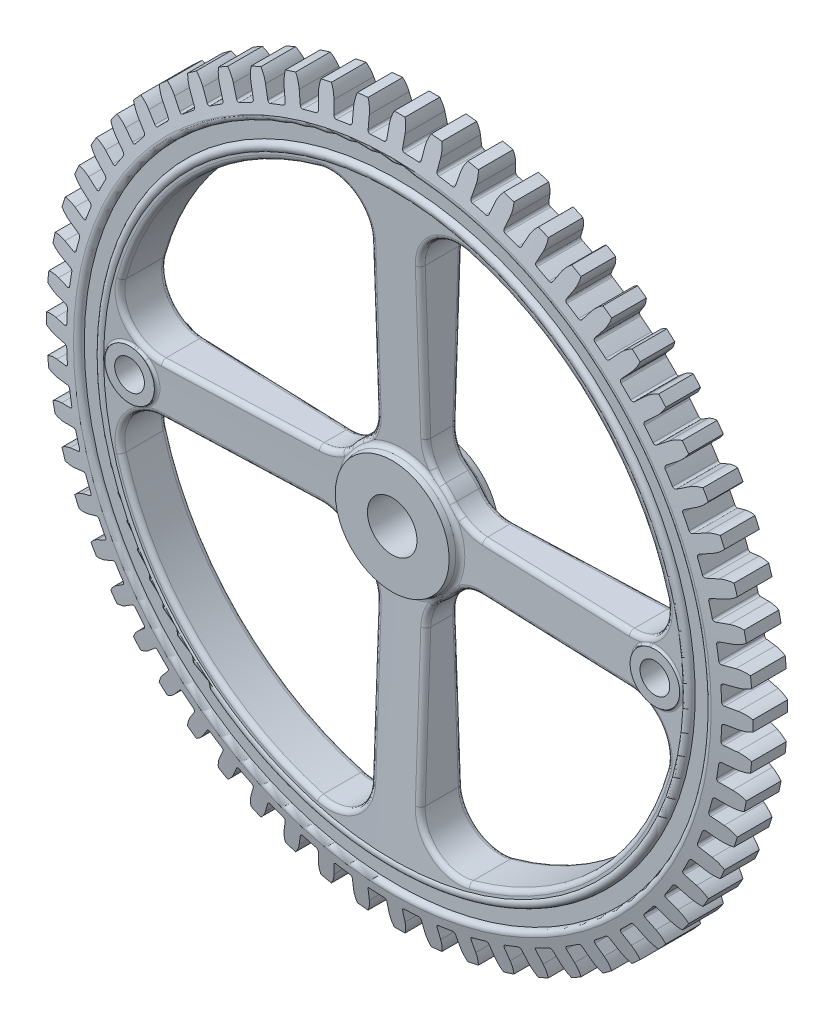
SolidWorks part; units mm, degrees
ref_plane "Спереди" through (0, 0, 0) normal (0, 0, 1) x (1, 0, 0)
ref_plane "Сверху" through (0, 0, 0) normal (0, 1, 0) x (1, 0, 0)
ref_plane "Справа" through (0, 0, 0) normal (1, 0, 0) x (0, 0, -1)
sketch "Эскиз1" plane through (0, 0, 0) normal (0, 1, 0) x (1, 0, 0)
  line L0 (-71.3, 0) -> (0, 0) construction
  line L1 (-71.3, -3.5) -> (-71.3, 3.5)
  line L2 (-5, 5) -> (-5, -5)
  line L3 (-5, 5) -> (-11.485, 5)
  line L4 (-71.3, 3.5) -> (-64.3459, 4.9781)
  line L5 (-63.138, 4) -> (-60.138, 4)
  line L6 (-11.485, 5) -> (-11.7073, 3.8775)
  line L7 (-12.7249, 3.0724) -> (-58.4765, 4.75)
  line L8 (-5, -5) -> (-11.485, -5)
  line L9 (-11.485, -5) -> (-11.7073, -3.8775)
  line L10 (-12.7249, -3.0724) -> (-58.4765, -4.75)
  line L11 (-63.138, -4) -> (-60.138, -4)
  line L12 (-71.3, -3.5) -> (-64.3459, -4.9781)
  line L13 (0, 5) -> (0, -5) construction
  arc A0 (-63.138, 4) -> (-64.3459, 4.9781) centre (-64.138, 4) ccw
  arc A1 (-58.4765, 4.75) -> (-60.138, 4) centre (-59.138, 4) ccw
  arc A2 (-11.7073, 3.8775) -> (-12.7249, 3.0724) centre (-12.6882, 4.0717) cw
  arc A3 (-11.7073, -3.8775) -> (-12.7249, -3.0724) centre (-12.6882, -4.0717) ccw
  arc A4 (-58.4765, -4.75) -> (-60.138, -4) centre (-59.138, -4) cw
  arc A5 (-63.138, -4) -> (-64.3459, -4.9781) centre (-64.138, -4) cw
  point P17 (-5, 0)
  dimension "D7" = 2
  dimension "D13" = 1
  dimension "D1" = 71.3
  dimension "D2" = 5
  dimension "D3" = 5
  dimension "D4" = 6.485
  dimension "D5" = 3.5
  dimension "D6" = 12
  dimension "D8" = 3
  dimension "D9" = 4
  dimension "D10" = 11.2
  dimension "D11" = 2.1
  dimension "D12" = 0.25
revolve "Повернуть1" add sketch "Эскиз1" angle 360 about L13
sketch "Эскиз2" plane through (0, 0, 0) normal (0, 0, 1) x (1, 0, 0)
  line L0 (0, 87.2902) -> (0, 0) construction
  line L1 (0, 0) -> (53, 0) construction
  line L2 (5, 47.244) -> (5, 16.4924)
  line L3 (16.4924, 5) -> (47.244, 5)
  line L4 (47.244, -5) -> (16.4924, -5)
  line L5 (5, -16.4924) -> (5, -47.244)
  line L6 (-5, -47.244) -> (-5, -16.4924)
  line L7 (-16.4924, -5) -> (-47.244, -5)
  line L8 (-47.244, 5) -> (-16.4924, 5)
  line L9 (-5, 16.4924) -> (-5, 47.244)
  line L10 (0, 0) -> (-53, 0) construction
  arc A0 (10.2096, 8.0476) -> (8.0476, 10.2096) centre (0, 0) ccw
  arc A1 (54.9574, 15.1224) -> (15.1224, 54.9574) centre (0, 0) ccw
  arc A2 (47.244, 5) -> (54.9574, 15.1224) centre (47.244, 13) ccw
  arc A3 (16.4924, 5) -> (10.2096, 8.0476) centre (16.4924, 13) cw
  arc A4 (5, 16.4924) -> (8.0476, 10.2096) centre (13, 16.4924) ccw
  arc A5 (5, 47.244) -> (15.1224, 54.9574) centre (13, 47.244) cw
  arc A6 (8.0476, -10.2096) -> (10.2096, -8.0476) centre (0, 0) ccw
  arc A7 (15.1224, -54.9574) -> (54.9574, -15.1224) centre (0, 0) ccw
  arc A8 (5, -47.244) -> (15.1224, -54.9574) centre (13, -47.244) ccw
  arc A9 (5, -16.4924) -> (8.0476, -10.2096) centre (13, -16.4924) cw
  arc A10 (16.4924, -5) -> (10.2096, -8.0476) centre (16.4924, -13) ccw
  arc A11 (47.244, -5) -> (54.9574, -15.1224) centre (47.244, -13) cw
  arc A12 (-10.2096, -8.0476) -> (-8.0476, -10.2096) centre (0, 0) ccw
  arc A13 (-54.9574, -15.1224) -> (-15.1224, -54.9574) centre (0, 0) ccw
  arc A14 (-47.244, -5) -> (-54.9574, -15.1224) centre (-47.244, -13) ccw
  arc A15 (-16.4924, -5) -> (-10.2096, -8.0476) centre (-16.4924, -13) cw
  arc A16 (-5, -16.4924) -> (-8.0476, -10.2096) centre (-13, -16.4924) ccw
  arc A17 (-5, -47.244) -> (-15.1224, -54.9574) centre (-13, -47.244) cw
  arc A18 (-8.0476, 10.2096) -> (-10.2096, 8.0476) centre (0, 0) ccw
  arc A19 (-15.1224, 54.9574) -> (-54.9574, 15.1224) centre (0, 0) ccw
  arc A20 (-5, 47.244) -> (-15.1224, 54.9574) centre (-13, 47.244) ccw
  arc A21 (-5, 16.4924) -> (-8.0476, 10.2096) centre (-13, 16.4924) cw
  arc A22 (-16.4924, 5) -> (-10.2096, 8.0476) centre (-16.4924, 13) ccw
  arc A23 (-47.244, 5) -> (-54.9574, 15.1224) centre (-47.244, 13) cw
  circle A24 centre (-53, 0) radius 3
  circle A25 centre (53, 0) radius 3
  dimension "D3" = 26
  dimension "D4" = 114
  dimension "D5" = 8
  dimension "D8" = 6
  dimension "D1" = 5
  dimension "D2" = 5
  dimension "D7" = 10
  dimension "D9" = 53
  dimension "D6" = 4
extrude "Вырез-Вытянуть1" cut sketch "Эскиз2" against normal mid plane 10
sketch "Эскиз4" plane through (0, 0, 0) normal (0, 0, 1) x (1, 0, 0)
  line L0 (-53, 0) -> (0, 0) construction
  line L1 (-53, 3) -> (-53, -3) construction
  line L2 (53, 3) -> (53, -3) construction
  line L3 (0, 0) -> (53, 0) construction
  circle A0 centre (-53, 0) radius 5
  circle A1 centre (-53, 0) radius 3 construction
  circle A2 centre (53, 0) radius 5
  circle A3 centre (53, 0) radius 3 construction
  circle A4 centre (-53, 0) radius 3
  circle A5 centre (53, 0) radius 3
  dimension "D2" = 10
extrude "Бобышка-Вытянуть1" add sketch "Эскиз4" along normal mid plane 10
fillet "Скругление1" radius 1 64 edges at (-12.1999, 6.2492, -3.1084) (-9.1924, 9.1924, -3.0825) (-5.4509, 13.8447, -3.1514) (-7.5875, 53.1351, -4.5739) (-40.3051, 40.3051, -4.6959) (-6.2492, -12.1999, -3.1084) (-9.1924, -9.1924, -3.0825) (-13.8447, -5.4509, -3.1514) (-53.1351, -7.5875, -4.5739) (-40.3051, -40.3051, -4.6959) (-8.7638, -54.0304, -4.6129) (12.1999, -6.2492, -3.1084) (9.1924, -9.1924, -3.0825) (5.4509, -13.8447, -3.1514) (7.5875, -53.1351, -4.5739) (40.3051, -40.3051, -4.6959) (54.0304, -8.7638, -4.6129) (53.1351, 7.5875, -4.5739) (40.3051, 40.3051, -4.6959) (8.7638, 54.0304, -4.6129) (6.2492, 12.1999, -3.1084) (9.1924, 9.1924, -3.0825) (13.8447, 5.4509, -3.1514) (12.1999, 6.2492, 3.1084) (9.1924, 9.1924, 3.0825) (5.4509, 13.8447, 3.1514) (7.5875, 53.1351, 4.5739) (40.3051, 40.3051, 4.6959) (54.0304, 8.7638, 4.6129) (53.1351, -7.5875, 4.5739) (40.3051, -40.3051, 4.6959) (8.7638, -54.0304, 4.6129) (6.2492, -12.1999, 3.1084) (9.1924, -9.1924, 3.0825) (13.8447, -5.4509, 3.1514) (-12.1999, -6.2492, 3.1084) (-9.1924, -9.1924, 3.0825) (-5.4509, -13.8447, 3.1514) (-7.5875, -53.1351, 4.5739) (-40.3051, -40.3051, 4.6959) (-54.0304, -8.7638, 4.6129) (-40.3051, 40.3051, 4.6959) (-8.7638, 54.0304, 4.6129) (-6.2492, 12.1999, 3.1084) (-9.1924, 9.1924, 3.0825) (-13.8447, 5.4509, 3.1514) (-54.0304, 8.7638, -4.6129) (-53.1351, 7.5875, 4.5739)
fillet "Скругление2" radius 0.5 4 edges at (57.2607, 2.6166, 4.7076) (-48.7562, 2.6439, 4.3962) (-50.3886, 4.2639, -4.46) (55.6381, 4.2474, -4.6519)
sketch "Эскиз5" plane through (0, 0, 0) normal (0, 0, 1) x (1, 0, 0)
  line L0 (0, 80.2004) -> (0, -81.6903) construction
  line L1 (0, 0) -> (3.6112, 68.9054) construction
  line L2 (-1.6, 68.8596) -> (-1.6, 66.5669)
  line L3 (1.6, 68.8596) -> (1.6, 66.5669)
  line L4 (5.6065, 68.6496) -> (5.3669, 66.3695)
  line L5 (8.789, 68.3151) -> (8.5494, 66.035)
  line L6 (12.7517, 67.6875) -> (12.275, 65.4449)
  line L7 (15.8817, 67.0222) -> (15.4051, 64.7796)
  line L8 (19.7571, 65.9838) -> (19.0486, 63.8033)
  line L9 (22.8005, 64.9949) -> (22.092, 62.8144)
  line L10 (26.546, 63.5571) -> (25.6135, 61.4627)
  line L11 (29.4694, 62.2556) -> (28.5369, 60.1611)
  line L12 (33.0441, 60.4341) -> (31.8978, 58.4486)
  line L13 (35.8154, 58.8341) -> (34.6691, 56.8486)
  line L14 (39.1802, 56.649) -> (37.8326, 54.7942)
  line L15 (41.7691, 54.7681) -> (40.4215, 52.9133)
  line L16 (44.887, 52.2432) -> (43.3529, 50.5394)
  line L17 (47.2651, 50.102) -> (45.731, 48.3982)
  line L18 (50.102, 47.2651) -> (48.3982, 45.731)
  line L19 (52.2432, 44.887) -> (50.5394, 43.3529)
  line L20 (54.7681, 41.7691) -> (52.9133, 40.4215)
  line L21 (56.649, 39.1802) -> (54.7942, 37.8326)
  line L22 (58.8341, 35.8154) -> (56.8486, 34.6691)
  line L23 (60.4341, 33.0441) -> (58.4486, 31.8978)
  line L24 (62.2556, 29.4694) -> (60.1611, 28.5369)
  line L25 (63.5571, 26.546) -> (61.4627, 25.6135)
  line L26 (64.9949, 22.8005) -> (62.8144, 22.092)
  line L27 (65.9838, 19.7571) -> (63.8033, 19.0486)
  line L28 (67.0222, 15.8817) -> (64.7796, 15.4051)
  line L29 (67.6875, 12.7517) -> (65.4449, 12.275)
  line L30 (68.3151, 8.789) -> (66.035, 8.5494)
  line L31 (68.6496, 5.6065) -> (66.3695, 5.3669)
  line L32 (68.8596, 1.6) -> (66.5669, 1.6)
  line L33 (68.8596, -1.6) -> (66.5669, -1.6)
  line L34 (68.6496, -5.6065) -> (66.3695, -5.3669)
  line L35 (68.3151, -8.789) -> (66.035, -8.5494)
  line L36 (67.6875, -12.7517) -> (65.4449, -12.275)
  line L37 (67.0222, -15.8817) -> (64.7796, -15.4051)
  line L38 (65.9838, -19.7571) -> (63.8033, -19.0486)
  line L39 (64.9949, -22.8005) -> (62.8144, -22.092)
  line L40 (63.5571, -26.546) -> (61.4627, -25.6135)
  line L41 (62.2556, -29.4694) -> (60.1611, -28.5369)
  line L42 (60.4341, -33.0441) -> (58.4486, -31.8978)
  line L43 (58.8341, -35.8154) -> (56.8486, -34.6691)
  line L44 (56.649, -39.1802) -> (54.7942, -37.8326)
  line L45 (54.7681, -41.7691) -> (52.9133, -40.4215)
  line L46 (52.2432, -44.887) -> (50.5394, -43.3529)
  line L47 (50.102, -47.2651) -> (48.3982, -45.731)
  line L48 (47.2651, -50.102) -> (45.731, -48.3982)
  line L49 (44.887, -52.2432) -> (43.3529, -50.5394)
  line L50 (41.7691, -54.7681) -> (40.4215, -52.9133)
  line L51 (39.1802, -56.649) -> (37.8326, -54.7942)
  line L52 (35.8154, -58.8341) -> (34.6691, -56.8486)
  line L53 (33.0441, -60.4341) -> (31.8978, -58.4486)
  line L54 (29.4694, -62.2556) -> (28.3391, -59.7169)
  line L55 (26.546, -63.5571) -> (25.6135, -61.4627)
  line L56 (22.8005, -64.9949) -> (22.092, -62.8144)
  line L57 (19.7571, -65.9838) -> (19.0486, -63.8033)
  line L58 (15.8817, -67.0222) -> (15.4051, -64.7796)
  line L59 (12.7517, -67.6875) -> (12.275, -65.4449)
  line L60 (8.789, -68.3151) -> (8.5494, -66.035)
  line L61 (5.6065, -68.6496) -> (5.3669, -66.3695)
  line L62 (1.6, -68.8596) -> (1.6, -66.5669)
  line L63 (-1.6, -68.8596) -> (-1.6, -66.5669)
  line L64 (-5.6065, -68.6496) -> (-5.3161, -65.8859)
  line L65 (-8.789, -68.3151) -> (-8.5494, -66.035)
  line L66 (-12.7517, -67.6875) -> (-12.275, -65.4449)
  line L67 (-15.8817, -67.0222) -> (-15.4051, -64.7796)
  line L68 (-19.7571, -65.9838) -> (-19.0486, -63.8033)
  line L69 (-22.8005, -64.9949) -> (-22.092, -62.8144)
  line L70 (-26.546, -63.5571) -> (-25.6135, -61.4627)
  line L71 (-29.4694, -62.2556) -> (-28.5369, -60.1611)
  line L72 (-33.0441, -60.4341) -> (-31.8978, -58.4486)
  line L73 (-35.8154, -58.8341) -> (-34.6691, -56.8486)
  line L74 (-39.1802, -56.649) -> (-37.8326, -54.7942)
  line L75 (-41.7691, -54.7681) -> (-40.4215, -52.9133)
  line L76 (-44.887, -52.2432) -> (-43.3529, -50.5394)
  line L77 (-47.2651, -50.102) -> (-45.731, -48.3982)
  line L78 (-50.102, -47.2651) -> (-48.3982, -45.731)
  line L79 (-52.2432, -44.887) -> (-50.5394, -43.3529)
  line L80 (-54.7681, -41.7691) -> (-52.9133, -40.4215)
  line L81 (-56.649, -39.1802) -> (-54.7942, -37.8326)
  line L82 (-58.8341, -35.8154) -> (-56.8486, -34.6691)
  line L83 (-60.4341, -33.0441) -> (-58.4486, -31.8978)
  line L84 (-62.2556, -29.4694) -> (-60.1611, -28.5369)
  line L85 (-63.5571, -26.546) -> (-61.4627, -25.6135)
  line L86 (-64.9949, -22.8005) -> (-62.8144, -22.092)
  line L87 (-65.9838, -19.7571) -> (-63.8033, -19.0486)
  line L88 (-67.0222, -15.8817) -> (-64.7796, -15.4051)
  line L89 (-67.6875, -12.7517) -> (-65.4449, -12.275)
  line L90 (-68.3151, -8.789) -> (-66.035, -8.5494)
  line L91 (-68.6496, -5.6065) -> (-66.3695, -5.3669)
  line L92 (-68.8596, -1.6) -> (-66.5669, -1.6)
  line L93 (-68.8596, 1.6) -> (-66.5669, 1.6)
  line L94 (-68.6496, 5.6065) -> (-66.3695, 5.3669)
  line L95 (-68.3151, 8.789) -> (-66.035, 8.5494)
  line L96 (-67.6875, 12.7517) -> (-65.4449, 12.275)
  line L97 (-67.0222, 15.8817) -> (-64.7796, 15.4051)
  line L98 (-65.9838, 19.7571) -> (-63.8033, 19.0486)
  line L99 (-64.9949, 22.8005) -> (-62.8144, 22.092)
  line L100 (-63.5571, 26.546) -> (-61.4627, 25.6135)
  line L101 (-62.2556, 29.4694) -> (-60.1611, 28.5369)
  line L102 (-60.4341, 33.0441) -> (-58.4486, 31.8978)
  line L103 (-58.8341, 35.8154) -> (-56.8486, 34.6691)
  line L104 (-56.649, 39.1802) -> (-54.7942, 37.8326)
  line L105 (-54.7681, 41.7691) -> (-52.9133, 40.4215)
  line L106 (-52.2432, 44.887) -> (-50.5394, 43.3529)
  line L107 (-50.102, 47.2651) -> (-48.3982, 45.731)
  line L108 (-47.2651, 50.102) -> (-45.731, 48.3982)
  line L109 (-44.887, 52.2432) -> (-43.3529, 50.5394)
  line L110 (-41.7691, 54.7681) -> (-40.4215, 52.9133)
  line L111 (-39.1802, 56.649) -> (-37.8326, 54.7942)
  line L112 (-35.8154, 58.8341) -> (-34.6691, 56.8486)
  line L113 (-33.0441, 60.4341) -> (-31.8978, 58.4486)
  line L114 (-29.4694, 62.2556) -> (-28.5369, 60.1611)
  line L115 (-26.546, 63.5571) -> (-25.6135, 61.4627)
  line L116 (-22.8005, 64.9949) -> (-22.092, 62.8144)
  line L117 (-19.7571, 65.9838) -> (-19.0486, 63.8033)
  line L118 (-15.8817, 67.0222) -> (-15.4051, 64.7796)
  line L119 (-12.7517, 67.6875) -> (-12.275, 65.4449)
  line L120 (-8.789, 68.3151) -> (-8.5494, 66.035)
  line L121 (-5.6065, 68.6496) -> (-5.3669, 66.3695)
  arc A0 (-2.0842, 66.0671) -> (-4.8331, 65.9231) centre (0, 0) ccw
  circle A1 centre (0, 0) radius 71.3 construction
  arc A2 (-1.0849, 71.2917) -> (-1.6, 68.8596) centre (4.4, 68.8596) ccw
  circle A3 centre (0, 0) radius 69 construction
  arc A4 (1.0849, 71.2917) -> (1.6, 68.8596) centre (-4.4, 68.8596) cw
  arc A5 (1.0849, 71.2917) -> (-1.0849, 71.2917) centre (0, 0) ccw
  arc A6 (6.373, 71.0146) -> (5.6065, 68.6496) centre (11.5737, 68.0224) ccw
  arc A7 (8.531, 70.7878) -> (8.789, 68.3151) centre (2.8219, 68.9423) cw
  arc A8 (8.531, 70.7878) -> (6.373, 71.0146) centre (0, 0) ccw
  arc A9 (13.7612, 69.9594) -> (12.7517, 67.6875) centre (18.6206, 66.44) ccw
  arc A10 (15.8836, 69.5083) -> (15.8817, 67.0222) centre (10.0129, 68.2696) cw
  arc A11 (15.8836, 69.5083) -> (13.7612, 69.9594) centre (0, 0) ccw
  arc A12 (20.9985, 68.1377) -> (19.7571, 65.9838) centre (25.4634, 64.1297) ccw
  arc A13 (23.0622, 67.4672) -> (22.8005, 64.9949) centre (17.0941, 66.849) cw
  arc A14 (23.0622, 67.4672) -> (20.9985, 68.1377) centre (0, 0) ccw
  arc A15 (28.0058, 65.5695) -> (26.546, 63.5571) centre (32.0273, 61.1167) ccw
  arc A16 (29.9881, 64.687) -> (29.4694, 62.2556) centre (23.9881, 64.696) cw
  arc A17 (29.9881, 64.687) -> (28.0058, 65.5695) centre (0, 0) ccw
  arc A18 (34.7063, 62.2829) -> (33.0441, 60.4341) centre (38.2403, 57.4341) ccw
  arc A19 (36.5855, 61.198) -> (35.8154, 58.8341) centre (30.6193, 61.8341) cw
  arc A20 (36.5855, 61.198) -> (34.7063, 62.2829) centre (0, 0) ccw
  arc A21 (41.0265, 58.3139) -> (39.1802, 56.649) centre (44.0343, 53.1223) ccw
  arc A22 (42.782, 57.0385) -> (41.7691, 54.7681) centre (36.915, 58.2948) cw
  arc A23 (42.782, 57.0385) -> (41.0265, 58.3139) centre (0, 0) ccw
  arc A24 (46.8972, 53.7061) -> (44.887, 52.2432) centre (49.3459, 48.2285) ccw
  arc A25 (48.5098, 52.2541) -> (47.2651, 50.102) centre (42.8062, 54.1168) cw
  arc A26 (48.5098, 52.2541) -> (46.8972, 53.7061) centre (0, 0) ccw
  arc A27 (52.2541, 48.5098) -> (50.102, 47.2651) centre (54.1168, 42.8062) ccw
  arc A28 (53.7061, 46.8972) -> (52.2432, 44.887) centre (48.2285, 49.3459) cw
  arc A29 (53.7061, 46.8972) -> (52.2541, 48.5098) centre (0, 0) ccw
  arc A30 (57.0385, 42.782) -> (54.7681, 41.7691) centre (58.2948, 36.915) ccw
  arc A31 (58.3139, 41.0265) -> (56.649, 39.1802) centre (53.1223, 44.0343) cw
  arc A32 (58.3139, 41.0265) -> (57.0385, 42.782) centre (0, 0) ccw
  arc A33 (61.198, 36.5855) -> (58.8341, 35.8154) centre (61.8341, 30.6193) ccw
  arc A34 (62.2829, 34.7063) -> (60.4341, 33.0441) centre (57.4341, 38.2403) cw
  arc A35 (62.2829, 34.7063) -> (61.198, 36.5855) centre (0, 0) ccw
  arc A36 (64.687, 29.9881) -> (62.2556, 29.4694) centre (64.696, 23.9881) ccw
  arc A37 (65.5695, 28.0058) -> (63.5571, 26.546) centre (61.1167, 32.0273) cw
  arc A38 (65.5695, 28.0058) -> (64.687, 29.9881) centre (0, 0) ccw
  arc A39 (67.4672, 23.0622) -> (64.9949, 22.8005) centre (66.849, 17.0941) ccw
  arc A40 (68.1377, 20.9985) -> (65.9838, 19.7571) centre (64.1297, 25.4634) cw
  arc A41 (68.1377, 20.9985) -> (67.4672, 23.0622) centre (0, 0) ccw
  arc A42 (69.5083, 15.8836) -> (67.0222, 15.8817) centre (68.2696, 10.0129) ccw
  arc A43 (69.9594, 13.7612) -> (67.6875, 12.7517) centre (66.44, 18.6206) cw
  arc A44 (69.9594, 13.7612) -> (69.5083, 15.8836) centre (0, 0) ccw
  arc A45 (70.7878, 8.531) -> (68.3151, 8.789) centre (68.9423, 2.8219) ccw
  arc A46 (71.0146, 6.373) -> (68.6496, 5.6065) centre (68.0224, 11.5737) cw
  arc A47 (71.0146, 6.373) -> (70.7878, 8.531) centre (0, 0) ccw
  arc A48 (71.2917, 1.0849) -> (68.8596, 1.6) centre (68.8596, -4.4) ccw
  arc A49 (71.2917, -1.0849) -> (68.8596, -1.6) centre (68.8596, 4.4) cw
  arc A50 (71.2917, -1.0849) -> (71.2917, 1.0849) centre (0, 0) ccw
  arc A51 (71.0146, -6.373) -> (68.6496, -5.6065) centre (68.0224, -11.5737) ccw
  arc A52 (70.7878, -8.531) -> (68.3151, -8.789) centre (68.9423, -2.8219) cw
  arc A53 (70.7878, -8.531) -> (71.0146, -6.373) centre (0, 0) ccw
  arc A54 (69.9594, -13.7612) -> (67.6875, -12.7517) centre (66.44, -18.6206) ccw
  arc A55 (69.5083, -15.8836) -> (67.0222, -15.8817) centre (68.2696, -10.0129) cw
  arc A56 (69.5083, -15.8836) -> (69.9594, -13.7612) centre (0, 0) ccw
  arc A57 (68.1377, -20.9985) -> (65.9838, -19.7571) centre (64.1297, -25.4634) ccw
  arc A58 (67.4672, -23.0622) -> (64.9949, -22.8005) centre (66.849, -17.0941) cw
  arc A59 (67.4672, -23.0622) -> (68.1377, -20.9985) centre (0, 0) ccw
  arc A60 (65.5695, -28.0058) -> (63.5571, -26.546) centre (61.1167, -32.0273) ccw
  arc A61 (64.687, -29.9881) -> (62.2556, -29.4694) centre (64.696, -23.9881) cw
  arc A62 (64.687, -29.9881) -> (65.5695, -28.0058) centre (0, 0) ccw
  arc A63 (62.2829, -34.7063) -> (60.4341, -33.0441) centre (57.4341, -38.2403) ccw
  arc A64 (61.198, -36.5855) -> (58.8341, -35.8154) centre (61.8341, -30.6193) cw
  arc A65 (61.198, -36.5855) -> (62.2829, -34.7063) centre (0, 0) ccw
  arc A66 (58.3139, -41.0265) -> (56.649, -39.1802) centre (53.1223, -44.0343) ccw
  arc A67 (57.0385, -42.782) -> (54.7681, -41.7691) centre (58.2948, -36.915) cw
  arc A68 (57.0385, -42.782) -> (58.3139, -41.0265) centre (0, 0) ccw
  arc A69 (53.7061, -46.8972) -> (52.2432, -44.887) centre (48.2285, -49.3459) ccw
  arc A70 (52.2541, -48.5098) -> (50.102, -47.2651) centre (54.1168, -42.8062) cw
  arc A71 (52.2541, -48.5098) -> (53.7061, -46.8972) centre (0, 0) ccw
  arc A72 (48.5098, -52.2541) -> (47.2651, -50.102) centre (42.8062, -54.1168) ccw
  arc A73 (46.8972, -53.7061) -> (44.887, -52.2432) centre (49.3459, -48.2285) cw
  arc A74 (46.8972, -53.7061) -> (48.5098, -52.2541) centre (0, 0) ccw
  arc A75 (42.782, -57.0385) -> (41.7691, -54.7681) centre (36.915, -58.2948) ccw
  arc A76 (41.0265, -58.3139) -> (39.1802, -56.649) centre (44.0343, -53.1223) cw
  arc A77 (41.0265, -58.3139) -> (42.782, -57.0385) centre (0, 0) ccw
  arc A78 (36.5855, -61.198) -> (35.8154, -58.8341) centre (30.6193, -61.8341) ccw
  arc A79 (34.7063, -62.2829) -> (33.0441, -60.4341) centre (38.2403, -57.4341) cw
  arc A80 (34.7063, -62.2829) -> (36.5855, -61.198) centre (0, 0) ccw
  arc A81 (29.9881, -64.687) -> (29.4694, -62.2556) centre (23.9881, -64.696) ccw
  arc A82 (28.0058, -65.5695) -> (26.546, -63.5571) centre (32.0273, -61.1167) cw
  arc A83 (28.0058, -65.5695) -> (29.9881, -64.687) centre (0, 0) ccw
  arc A84 (23.0622, -67.4672) -> (22.8005, -64.9949) centre (17.0941, -66.849) ccw
  arc A85 (20.9985, -68.1377) -> (19.7571, -65.9838) centre (25.4634, -64.1297) cw
  arc A86 (20.9985, -68.1377) -> (23.0622, -67.4672) centre (0, 0) ccw
  arc A87 (15.8836, -69.5083) -> (15.8817, -67.0222) centre (10.0129, -68.2696) ccw
  arc A88 (13.7612, -69.9594) -> (12.7517, -67.6875) centre (18.6206, -66.44) cw
  arc A89 (13.7612, -69.9594) -> (15.8836, -69.5083) centre (0, 0) ccw
  arc A90 (8.531, -70.7878) -> (8.789, -68.3151) centre (2.8219, -68.9423) ccw
  arc A91 (6.373, -71.0146) -> (5.6065, -68.6496) centre (11.5737, -68.0224) cw
  arc A92 (6.373, -71.0146) -> (8.531, -70.7878) centre (0, 0) ccw
  arc A93 (1.0849, -71.2917) -> (1.6, -68.8596) centre (-4.4, -68.8596) ccw
  arc A94 (-1.0849, -71.2917) -> (-1.6, -68.8596) centre (4.4, -68.8596) cw
  arc A95 (-1.0849, -71.2917) -> (1.0849, -71.2917) centre (0, 0) ccw
  arc A96 (-6.373, -71.0146) -> (-5.6065, -68.6496) centre (-11.5737, -68.0224) ccw
  arc A97 (-8.531, -70.7878) -> (-8.789, -68.3151) centre (-2.8219, -68.9423) cw
  arc A98 (-8.531, -70.7878) -> (-6.373, -71.0146) centre (0, 0) ccw
  arc A99 (-13.7612, -69.9594) -> (-12.7517, -67.6875) centre (-18.6206, -66.44) ccw
  arc A100 (-15.8836, -69.5083) -> (-15.8817, -67.0222) centre (-10.0129, -68.2696) cw
  arc A101 (-15.8836, -69.5083) -> (-13.7612, -69.9594) centre (0, 0) ccw
  arc A102 (-20.9985, -68.1377) -> (-19.7571, -65.9838) centre (-25.4634, -64.1297) ccw
  arc A103 (-23.0622, -67.4672) -> (-22.8005, -64.9949) centre (-17.0941, -66.849) cw
  arc A104 (-23.0622, -67.4672) -> (-20.9985, -68.1377) centre (0, 0) ccw
  arc A105 (-28.0058, -65.5695) -> (-26.546, -63.5571) centre (-32.0273, -61.1167) ccw
  arc A106 (-29.9881, -64.687) -> (-29.4694, -62.2556) centre (-23.9881, -64.696) cw
  arc A107 (-29.9881, -64.687) -> (-28.0058, -65.5695) centre (0, 0) ccw
  arc A108 (-34.7063, -62.2829) -> (-33.0441, -60.4341) centre (-38.2403, -57.4341) ccw
  arc A109 (-36.5855, -61.198) -> (-35.8154, -58.8341) centre (-30.6193, -61.8341) cw
  arc A110 (-36.5855, -61.198) -> (-34.7063, -62.2829) centre (0, 0) ccw
  arc A111 (-41.0265, -58.3139) -> (-39.1802, -56.649) centre (-44.0343, -53.1223) ccw
  arc A112 (-42.782, -57.0385) -> (-41.7691, -54.7681) centre (-36.915, -58.2948) cw
  arc A113 (-42.782, -57.0385) -> (-41.0265, -58.3139) centre (0, 0) ccw
  arc A114 (-46.8972, -53.7061) -> (-44.887, -52.2432) centre (-49.3459, -48.2285) ccw
  arc A115 (-48.5098, -52.2541) -> (-47.2651, -50.102) centre (-42.8062, -54.1168) cw
  arc A116 (-48.5098, -52.2541) -> (-46.8972, -53.7061) centre (0, 0) ccw
  arc A117 (-52.2541, -48.5098) -> (-50.102, -47.2651) centre (-54.1168, -42.8062) ccw
  arc A118 (-53.7061, -46.8972) -> (-52.2432, -44.887) centre (-48.2285, -49.3459) cw
  arc A119 (-53.7061, -46.8972) -> (-52.2541, -48.5098) centre (0, 0) ccw
  arc A120 (-57.0385, -42.782) -> (-54.7681, -41.7691) centre (-58.2948, -36.915) ccw
  arc A121 (-58.3139, -41.0265) -> (-56.649, -39.1802) centre (-53.1223, -44.0343) cw
  arc A122 (-58.3139, -41.0265) -> (-57.0385, -42.782) centre (0, 0) ccw
  arc A123 (-61.198, -36.5855) -> (-58.8341, -35.8154) centre (-61.8341, -30.6193) ccw
  arc A124 (-62.2829, -34.7063) -> (-60.4341, -33.0441) centre (-57.4341, -38.2403) cw
  arc A125 (-62.2829, -34.7063) -> (-61.198, -36.5855) centre (0, 0) ccw
  arc A126 (-64.687, -29.9881) -> (-62.2556, -29.4694) centre (-64.696, -23.9881) ccw
  arc A127 (-65.5695, -28.0058) -> (-63.5571, -26.546) centre (-61.1167, -32.0273) cw
  arc A128 (-65.5695, -28.0058) -> (-64.687, -29.9881) centre (0, 0) ccw
  arc A129 (-67.4672, -23.0622) -> (-64.9949, -22.8005) centre (-66.849, -17.0941) ccw
  arc A130 (-68.1377, -20.9985) -> (-65.9838, -19.7571) centre (-64.1297, -25.4634) cw
  arc A131 (-68.1377, -20.9985) -> (-67.4672, -23.0622) centre (0, 0) ccw
  arc A132 (-69.5083, -15.8836) -> (-67.0222, -15.8817) centre (-68.2696, -10.0129) ccw
  arc A133 (-69.9594, -13.7612) -> (-67.6875, -12.7517) centre (-66.44, -18.6206) cw
  arc A134 (-69.9594, -13.7612) -> (-69.5083, -15.8836) centre (0, 0) ccw
  arc A135 (-70.7878, -8.531) -> (-68.3151, -8.789) centre (-68.9423, -2.8219) ccw
  arc A136 (-71.0146, -6.373) -> (-68.6496, -5.6065) centre (-68.0224, -11.5737) cw
  arc A137 (-71.0146, -6.373) -> (-70.7878, -8.531) centre (0, 0) ccw
  arc A138 (-71.2917, -1.0849) -> (-68.8596, -1.6) centre (-68.8596, 4.4) ccw
  arc A139 (-71.2917, 1.0849) -> (-68.8596, 1.6) centre (-68.8596, -4.4) cw
  arc A140 (-71.2917, 1.0849) -> (-71.2917, -1.0849) centre (0, 0) ccw
  arc A141 (-71.0146, 6.373) -> (-68.6496, 5.6065) centre (-68.0224, 11.5737) ccw
  arc A142 (-70.7878, 8.531) -> (-68.3151, 8.789) centre (-68.9423, 2.8219) cw
  arc A143 (-70.7878, 8.531) -> (-71.0146, 6.373) centre (0, 0) ccw
  arc A144 (-69.9594, 13.7612) -> (-67.6875, 12.7517) centre (-66.44, 18.6206) ccw
  arc A145 (-69.5083, 15.8836) -> (-67.0222, 15.8817) centre (-68.2696, 10.0129) cw
  arc A146 (-69.5083, 15.8836) -> (-69.9594, 13.7612) centre (0, 0) ccw
  arc A147 (-68.1377, 20.9985) -> (-65.9838, 19.7571) centre (-64.1297, 25.4634) ccw
  arc A148 (-67.4672, 23.0622) -> (-64.9949, 22.8005) centre (-66.849, 17.0941) cw
  arc A149 (-67.4672, 23.0622) -> (-68.1377, 20.9985) centre (0, 0) ccw
  arc A150 (-65.5695, 28.0058) -> (-63.5571, 26.546) centre (-61.1167, 32.0273) ccw
  arc A151 (-64.687, 29.9881) -> (-62.2556, 29.4694) centre (-64.696, 23.9881) cw
  arc A152 (-64.687, 29.9881) -> (-65.5695, 28.0058) centre (0, 0) ccw
  arc A153 (-62.2829, 34.7063) -> (-60.4341, 33.0441) centre (-57.4341, 38.2403) ccw
  arc A154 (-61.198, 36.5855) -> (-58.8341, 35.8154) centre (-61.8341, 30.6193) cw
  arc A155 (-61.198, 36.5855) -> (-62.2829, 34.7063) centre (0, 0) ccw
  arc A156 (-58.3139, 41.0265) -> (-56.649, 39.1802) centre (-53.1223, 44.0343) ccw
  arc A157 (-57.0385, 42.782) -> (-54.7681, 41.7691) centre (-58.2948, 36.915) cw
  arc A158 (-57.0385, 42.782) -> (-58.3139, 41.0265) centre (0, 0) ccw
  arc A159 (-53.7061, 46.8972) -> (-52.2432, 44.887) centre (-48.2285, 49.3459) ccw
  arc A160 (-52.2541, 48.5098) -> (-50.102, 47.2651) centre (-54.1168, 42.8062) cw
  arc A161 (-52.2541, 48.5098) -> (-53.7061, 46.8972) centre (0, 0) ccw
  arc A162 (-48.5098, 52.2541) -> (-47.2651, 50.102) centre (-42.8062, 54.1168) ccw
  arc A163 (-46.8972, 53.7061) -> (-44.887, 52.2432) centre (-49.3459, 48.2285) cw
  arc A164 (-46.8972, 53.7061) -> (-48.5098, 52.2541) centre (0, 0) ccw
  arc A165 (-42.782, 57.0385) -> (-41.7691, 54.7681) centre (-36.915, 58.2948) ccw
  arc A166 (-41.0265, 58.3139) -> (-39.1802, 56.649) centre (-44.0343, 53.1223) cw
  arc A167 (-41.0265, 58.3139) -> (-42.782, 57.0385) centre (0, 0) ccw
  arc A168 (-36.5855, 61.198) -> (-35.8154, 58.8341) centre (-30.6193, 61.8341) ccw
  arc A169 (-34.7063, 62.2829) -> (-33.0441, 60.4341) centre (-38.2403, 57.4341) cw
  arc A170 (-34.7063, 62.2829) -> (-36.5855, 61.198) centre (0, 0) ccw
  arc A171 (-29.9881, 64.687) -> (-29.4694, 62.2556) centre (-23.9881, 64.696) ccw
  arc A172 (-28.0058, 65.5695) -> (-26.546, 63.5571) centre (-32.0273, 61.1167) cw
  arc A173 (-28.0058, 65.5695) -> (-29.9881, 64.687) centre (0, 0) ccw
  arc A174 (-23.0622, 67.4672) -> (-22.8005, 64.9949) centre (-17.0941, 66.849) ccw
  arc A175 (-20.9985, 68.1377) -> (-19.7571, 65.9838) centre (-25.4634, 64.1297) cw
  arc A176 (-20.9985, 68.1377) -> (-23.0622, 67.4672) centre (0, 0) ccw
  arc A177 (-15.8836, 69.5083) -> (-15.8817, 67.0222) centre (-10.0129, 68.2696) ccw
  arc A178 (-13.7612, 69.9594) -> (-12.7517, 67.6875) centre (-18.6206, 66.44) cw
  arc A179 (-13.7612, 69.9594) -> (-15.8836, 69.5083) centre (0, 0) ccw
  arc A180 (-8.531, 70.7878) -> (-8.789, 68.3151) centre (-2.8219, 68.9423) ccw
  arc A181 (-6.373, 71.0146) -> (-5.6065, 68.6496) centre (-11.5737, 68.0224) cw
  arc A182 (-6.373, 71.0146) -> (-8.531, 70.7878) centre (0, 0) ccw
  arc A183 (-22.3981, 62.1895) -> (-24.9679, 61.2031) centre (0, 0) ccw
  arc A184 (-28.776, 59.5076) -> (-31.2286, 58.2579) centre (0, 0) ccw
  arc A185 (-15.7748, 64.1901) -> (-18.4336, 63.4776) centre (0, 0) ccw
  arc A186 (-8.9787, 65.4873) -> (-11.6974, 65.0567) centre (0, 0) ccw
  arc A187 (4.8331, 65.9231) -> (2.0842, 66.0671) centre (0, 0) ccw
  arc A188 (11.6974, 65.0567) -> (8.9787, 65.4873) centre (0, 0) ccw
  arc A189 (18.4336, 63.4776) -> (15.7748, 64.1901) centre (0, 0) ccw
  arc A190 (-34.8386, 56.1737) -> (-37.1471, 54.6745) centre (0, 0) ccw
  arc A191 (-40.5195, 52.2244) -> (-42.6587, 50.4921) centre (0, 0) ccw
  arc A192 (24.9679, 61.2031) -> (22.3981, 62.1895) centre (0, 0) ccw
  arc A193 (31.2286, 58.2579) -> (28.776, 59.5076) centre (0, 0) ccw
  arc A194 (37.1471, 54.6745) -> (34.8386, 56.1737) centre (0, 0) ccw
  arc A195 (42.6587, 50.4921) -> (40.5195, 52.2244) centre (0, 0) ccw
  arc A196 (47.7028, 45.7564) -> (45.7564, 47.7028) centre (0, 0) ccw
  arc A197 (52.2244, 40.5195) -> (50.4921, 42.6587) centre (0, 0) ccw
  arc A198 (56.1737, 34.8386) -> (54.6745, 37.1471) centre (0, 0) ccw
  arc A199 (59.5076, 28.776) -> (58.2579, 31.2286) centre (0, 0) ccw
  arc A200 (62.1895, 22.3981) -> (61.2031, 24.9679) centre (0, 0) ccw
  arc A201 (64.1901, 15.7748) -> (63.4776, 18.4336) centre (0, 0) ccw
  arc A202 (65.4873, 8.9787) -> (65.0567, 11.6974) centre (0, 0) ccw
  arc A203 (66.0671, 2.0842) -> (65.9231, 4.8331) centre (0, 0) ccw
  arc A204 (65.9231, -4.8331) -> (66.0671, -2.0842) centre (0, 0) ccw
  arc A205 (65.0567, -11.6974) -> (65.4873, -8.9787) centre (0, 0) ccw
  arc A206 (63.4776, -18.4336) -> (64.1901, -15.7748) centre (0, 0) ccw
  arc A207 (58.2579, -31.2286) -> (59.5076, -28.776) centre (0, 0) ccw
  arc A208 (61.2031, -24.9679) -> (62.1895, -22.3981) centre (0, 0) ccw
  arc A209 (54.6745, -37.1471) -> (56.1737, -34.8386) centre (0, 0) ccw
  arc A210 (2.0842, -66.0671) -> (4.8331, -65.9231) centre (0, 0) ccw
  arc A211 (8.9787, -65.4873) -> (11.6974, -65.0567) centre (0, 0) ccw
  arc A212 (15.7748, -64.1901) -> (18.4336, -63.4776) centre (0, 0) ccw
  arc A213 (22.3981, -62.1895) -> (24.9679, -61.2031) centre (0, 0) ccw
  arc A214 (28.3391, -59.7169) -> (31.2286, -58.2579) centre (0, 0) ccw
  arc A215 (34.8386, -56.1737) -> (37.1471, -54.6745) centre (0, 0) ccw
  arc A216 (40.5195, -52.2244) -> (42.6587, -50.4921) centre (0, 0) ccw
  arc A217 (45.7564, -47.7028) -> (47.7028, -45.7564) centre (0, 0) ccw
  arc A218 (50.4921, -42.6587) -> (52.2244, -40.5195) centre (0, 0) ccw
  arc A219 (-5.3161, -65.8859) -> (-2.0842, -66.0671) centre (0, 0) ccw
  arc A220 (-11.6974, -65.0567) -> (-8.9787, -65.4873) centre (0, 0) ccw
  arc A221 (-18.4336, -63.4776) -> (-15.7748, -64.1901) centre (0, 0) ccw
  arc A222 (-24.9679, -61.2031) -> (-22.3981, -62.1895) centre (0, 0) ccw
  arc A223 (-31.2286, -58.2579) -> (-28.776, -59.5076) centre (0, 0) ccw
  arc A224 (-37.1471, -54.6745) -> (-34.8386, -56.1737) centre (0, 0) ccw
  arc A225 (-42.6587, -50.4921) -> (-40.5195, -52.2244) centre (0, 0) ccw
  arc A226 (-47.7028, -45.7564) -> (-45.7564, -47.7028) centre (0, 0) ccw
  arc A227 (-52.2244, -40.5195) -> (-50.4921, -42.6587) centre (0, 0) ccw
  arc A228 (-56.1737, -34.8386) -> (-54.6745, -37.1471) centre (0, 0) ccw
  arc A229 (-59.5076, -28.776) -> (-58.2579, -31.2286) centre (0, 0) ccw
  arc A230 (-62.1895, -22.3981) -> (-61.2031, -24.9679) centre (0, 0) ccw
  arc A231 (-64.1901, -15.7748) -> (-63.4776, -18.4336) centre (0, 0) ccw
  arc A232 (-65.4873, -8.9787) -> (-65.0567, -11.6974) centre (0, 0) ccw
  arc A233 (-66.0671, -2.0842) -> (-65.9231, -4.8331) centre (0, 0) ccw
  arc A234 (-65.9231, 4.8331) -> (-66.0671, 2.0842) centre (0, 0) ccw
  arc A235 (-65.0567, 11.6974) -> (-65.4873, 8.9787) centre (0, 0) ccw
  arc A236 (-63.4776, 18.4336) -> (-64.1901, 15.7748) centre (0, 0) ccw
  arc A237 (-61.2031, 24.9679) -> (-62.1895, 22.3981) centre (0, 0) ccw
  arc A238 (-58.2579, 31.2286) -> (-59.5076, 28.776) centre (0, 0) ccw
  arc A239 (-54.6745, 37.1471) -> (-56.1737, 34.8386) centre (0, 0) ccw
  arc A240 (-50.4921, 42.6587) -> (-52.2244, 40.5195) centre (0, 0) ccw
  arc A241 (-45.7564, 47.7028) -> (-47.7028, 45.7564) centre (0, 0) ccw
  arc A242 (-22.092, 62.8144) -> (-22.3981, 62.1895) centre (-22.5675, 62.6599) cw
  arc A243 (-25.6135, 61.4627) -> (-24.9679, 61.2031) centre (-25.1567, 61.666) ccw
  arc A244 (-28.5369, 60.1611) -> (-28.776, 59.5076) centre (-28.9936, 59.9577) cw
  arc A245 (-31.8978, 58.4486) -> (-31.2286, 58.2579) centre (-31.4648, 58.6986) ccw
  arc A246 (-34.6691, 56.8486) -> (-34.8386, 56.1737) centre (-35.1021, 56.5986) cw
  arc A247 (-37.8326, 54.7942) -> (-37.1471, 54.6745) centre (-37.4281, 55.0881) ccw
  arc A248 (-40.4215, 52.9133) -> (-40.5195, 52.2244) centre (-40.826, 52.6194) cw
  arc A249 (-43.3529, 50.5394) -> (-42.6587, 50.4921) centre (-42.9813, 50.874) ccw
  arc A250 (-45.731, 48.3982) -> (-45.7564, 47.7028) centre (-46.1025, 48.0637) cw
  arc A251 (-48.3982, 45.731) -> (-47.7028, 45.7564) centre (-48.0637, 46.1025) ccw
  arc A252 (-50.5394, 43.3529) -> (-50.4921, 42.6587) centre (-50.874, 42.9813) cw
  arc A253 (-52.9133, 40.4215) -> (-52.2244, 40.5195) centre (-52.6194, 40.826) ccw
  arc A254 (-54.7942, 37.8326) -> (-54.6745, 37.1471) centre (-55.0881, 37.4281) cw
  arc A255 (-56.8486, 34.6691) -> (-56.1737, 34.8386) centre (-56.5986, 35.1021) ccw
  arc A256 (-58.4486, 31.8978) -> (-58.2579, 31.2286) centre (-58.6986, 31.4648) cw
  arc A257 (-60.1611, 28.5369) -> (-59.5076, 28.776) centre (-59.9577, 28.9936) ccw
  arc A258 (-61.4627, 25.6135) -> (-61.2031, 24.9679) centre (-61.666, 25.1567) cw
  arc A259 (-62.8144, 22.092) -> (-62.1895, 22.3981) centre (-62.6599, 22.5675) ccw
  arc A260 (-63.8033, 19.0486) -> (-63.4776, 18.4336) centre (-63.9578, 18.5731) cw
  arc A261 (-64.7796, 15.4051) -> (-64.1901, 15.7748) centre (-64.6756, 15.8941) ccw
  arc A262 (-65.4449, 12.275) -> (-65.0567, 11.6974) centre (-65.5489, 11.7859) cw
  arc A263 (-66.035, 8.5494) -> (-65.4873, 8.9787) centre (-65.9827, 9.0466) ccw
  arc A264 (-66.3695, 5.3669) -> (-65.9231, 4.8331) centre (-66.4217, 4.8696) cw
  arc A265 (-66.5669, 1.6) -> (-66.0671, 2.0842) centre (-66.5669, 2.1) ccw
  arc A266 (-66.5669, -1.6) -> (-66.0671, -2.0842) centre (-66.5669, -2.1) cw
  arc A267 (-66.3695, -5.3669) -> (-65.9231, -4.8331) centre (-66.4217, -4.8696) ccw
  arc A268 (-64.7796, -15.4051) -> (-64.1901, -15.7748) centre (-64.6756, -15.8941) cw
  arc A269 (-65.4449, -12.275) -> (-65.0567, -11.6974) centre (-65.5489, -11.7859) ccw
  arc A270 (-66.035, -8.5494) -> (-65.4873, -8.9787) centre (-65.9827, -9.0466) cw
  arc A271 (-63.8033, -19.0486) -> (-63.4776, -18.4336) centre (-63.9578, -18.5731) ccw
  arc A272 (-62.8144, -22.092) -> (-62.1895, -22.3981) centre (-62.6599, -22.5675) cw
  arc A273 (-61.4627, -25.6135) -> (-61.2031, -24.9679) centre (-61.666, -25.1567) ccw
  arc A274 (-58.4486, -31.8978) -> (-58.2579, -31.2286) centre (-58.6986, -31.4648) ccw
  arc A275 (-60.1611, -28.5369) -> (-59.5076, -28.776) centre (-59.9577, -28.9936) cw
  arc A276 (-56.8486, -34.6691) -> (-56.1737, -34.8386) centre (-56.5986, -35.1021) cw
  arc A277 (-54.7942, -37.8326) -> (-54.6745, -37.1471) centre (-55.0881, -37.4281) ccw
  arc A278 (-52.9133, -40.4215) -> (-52.2244, -40.5195) centre (-52.6194, -40.826) cw
  arc A279 (-50.5394, -43.3529) -> (-50.4921, -42.6587) centre (-50.874, -42.9813) ccw
  arc A280 (-48.3982, -45.731) -> (-47.7028, -45.7564) centre (-48.0637, -46.1025) cw
  arc A281 (-45.731, -48.3982) -> (-45.7564, -47.7028) centre (-46.1025, -48.0637) ccw
  arc A282 (-40.4215, -52.9133) -> (-40.5195, -52.2244) centre (-40.826, -52.6194) ccw
  arc A283 (-43.3529, -50.5394) -> (-42.6587, -50.4921) centre (-42.9813, -50.874) cw
  arc A284 (-37.8326, -54.7942) -> (-37.1471, -54.6745) centre (-37.4281, -55.0881) cw
  arc A285 (-34.6691, -56.8486) -> (-34.8386, -56.1737) centre (-35.1021, -56.5986) ccw
  arc A286 (-31.8978, -58.4486) -> (-31.2286, -58.2579) centre (-31.4648, -58.6986) cw
  arc A287 (-28.5369, -60.1611) -> (-28.776, -59.5076) centre (-28.9936, -59.9577) ccw
  arc A288 (-25.6135, -61.4627) -> (-24.9679, -61.2031) centre (-25.1567, -61.666) cw
  arc A289 (-12.275, -65.4449) -> (-11.6974, -65.0567) centre (-11.7859, -65.5489) cw
  arc A290 (-15.4051, -64.7796) -> (-15.7748, -64.1901) centre (-15.8941, -64.6756) ccw
  arc A291 (-22.092, -62.8144) -> (-22.3981, -62.1895) centre (-22.5675, -62.6599) ccw
  arc A292 (-19.0486, -63.8033) -> (-18.4336, -63.4776) centre (-18.5731, -63.9578) cw
  arc A293 (-8.5494, -66.035) -> (-8.9787, -65.4873) centre (-9.0466, -65.9827) ccw
  arc A294 (-1.6, -66.5669) -> (-2.0842, -66.0671) centre (-2.1, -66.5669) ccw
  arc A295 (5.3669, -66.3695) -> (4.8331, -65.9231) centre (4.8696, -66.4217) ccw
  arc A296 (1.6, -66.5669) -> (2.0842, -66.0671) centre (2.1, -66.5669) cw
  arc A297 (8.5494, -66.035) -> (8.9787, -65.4873) centre (9.0466, -65.9827) cw
  arc A298 (12.275, -65.4449) -> (11.6974, -65.0567) centre (11.7859, -65.5489) ccw
  arc A299 (25.6135, -61.4627) -> (24.9679, -61.2031) centre (25.1567, -61.666) ccw
  arc A300 (22.092, -62.8144) -> (22.3981, -62.1895) centre (22.5675, -62.6599) cw
  arc A301 (19.0486, -63.8033) -> (18.4336, -63.4776) centre (18.5731, -63.9578) ccw
  arc A302 (15.4051, -64.7796) -> (15.7748, -64.1901) centre (15.8941, -64.6756) cw
  arc A303 (31.8978, -58.4486) -> (31.2286, -58.2579) centre (31.4648, -58.6986) ccw
  arc A304 (34.6691, -56.8486) -> (34.8386, -56.1737) centre (35.1021, -56.5986) cw
  arc A305 (37.8326, -54.7942) -> (37.1471, -54.6745) centre (37.4281, -55.0881) ccw
  arc A306 (40.4215, -52.9133) -> (40.5195, -52.2244) centre (40.826, -52.6194) cw
  arc A307 (43.3529, -50.5394) -> (42.6587, -50.4921) centre (42.9813, -50.874) ccw
  arc A308 (48.3982, -45.731) -> (47.7028, -45.7564) centre (48.0637, -46.1025) ccw
  arc A309 (45.731, -48.3982) -> (45.7564, -47.7028) centre (46.1025, -48.0637) cw
  arc A310 (50.5394, -43.3529) -> (50.4921, -42.6587) centre (50.874, -42.9813) cw
  arc A311 (52.9133, -40.4215) -> (52.2244, -40.5195) centre (52.6194, -40.826) ccw
  arc A312 (54.7942, -37.8326) -> (54.6745, -37.1471) centre (55.0881, -37.4281) cw
  arc A313 (56.8486, -34.6691) -> (56.1737, -34.8386) centre (56.5986, -35.1021) ccw
  arc A314 (60.1611, -28.5369) -> (59.5076, -28.776) centre (59.9577, -28.9936) ccw
  arc A315 (58.4486, -31.8978) -> (58.2579, -31.2286) centre (58.6986, -31.4648) cw
  arc A316 (61.4627, -25.6135) -> (61.2031, -24.9679) centre (61.666, -25.1567) cw
  arc A317 (62.8144, -22.092) -> (62.1895, -22.3981) centre (62.6599, -22.5675) ccw
  arc A318 (63.8033, -19.0486) -> (63.4776, -18.4336) centre (63.9578, -18.5731) cw
  arc A319 (64.7796, -15.4051) -> (64.1901, -15.7748) centre (64.6756, -15.8941) ccw
  arc A320 (65.4449, -12.275) -> (65.0567, -11.6974) centre (65.5489, -11.7859) cw
  arc A321 (66.035, -8.5494) -> (65.4873, -8.9787) centre (65.9827, -9.0466) ccw
  arc A322 (66.3695, -5.3669) -> (65.9231, -4.8331) centre (66.4217, -4.8696) cw
  arc A323 (66.5669, -1.6) -> (66.0671, -2.0842) centre (66.5669, -2.1) ccw
  arc A324 (66.5669, 1.6) -> (66.0671, 2.0842) centre (66.5669, 2.1) cw
  arc A325 (66.3695, 5.3669) -> (65.9231, 4.8331) centre (66.4217, 4.8696) ccw
  arc A326 (66.035, 8.5494) -> (65.4873, 8.9787) centre (65.9827, 9.0466) cw
  arc A327 (65.4449, 12.275) -> (65.0567, 11.6974) centre (65.5489, 11.7859) ccw
  arc A328 (64.7796, 15.4051) -> (64.1901, 15.7748) centre (64.6756, 15.8941) cw
  arc A329 (63.8033, 19.0486) -> (63.4776, 18.4336) centre (63.9578, 18.5731) ccw
  arc A330 (62.8144, 22.092) -> (62.1895, 22.3981) centre (62.6599, 22.5675) cw
  arc A331 (61.4627, 25.6135) -> (61.2031, 24.9679) centre (61.666, 25.1567) ccw
  arc A332 (60.1611, 28.5369) -> (59.5076, 28.776) centre (59.9577, 28.9936) cw
  arc A333 (58.4486, 31.8978) -> (58.2579, 31.2286) centre (58.6986, 31.4648) ccw
  arc A334 (56.8486, 34.6691) -> (56.1737, 34.8386) centre (56.5986, 35.1021) cw
  arc A335 (54.7942, 37.8326) -> (54.6745, 37.1471) centre (55.0881, 37.4281) ccw
  arc A336 (52.9133, 40.4215) -> (52.2244, 40.5195) centre (52.6194, 40.826) cw
  arc A337 (50.5394, 43.3529) -> (50.4921, 42.6587) centre (50.874, 42.9813) ccw
  arc A338 (48.3982, 45.731) -> (47.7028, 45.7564) centre (48.0637, 46.1025) cw
  arc A339 (45.731, 48.3982) -> (45.7564, 47.7028) centre (46.1025, 48.0637) ccw
  arc A340 (43.3529, 50.5394) -> (42.6587, 50.4921) centre (42.9813, 50.874) cw
  arc A341 (40.4215, 52.9133) -> (40.5195, 52.2244) centre (40.826, 52.6194) ccw
  arc A342 (37.8326, 54.7942) -> (37.1471, 54.6745) centre (37.4281, 55.0881) cw
  arc A343 (34.6691, 56.8486) -> (34.8386, 56.1737) centre (35.1021, 56.5986) ccw
  arc A344 (31.8978, 58.4486) -> (31.2286, 58.2579) centre (31.4648, 58.6986) cw
  arc A345 (28.5369, 60.1611) -> (28.776, 59.5076) centre (28.9936, 59.9577) ccw
  arc A346 (25.6135, 61.4627) -> (24.9679, 61.2031) centre (25.1567, 61.666) cw
  arc A347 (22.092, 62.8144) -> (22.3981, 62.1895) centre (22.5675, 62.6599) ccw
  arc A348 (19.0486, 63.8033) -> (18.4336, 63.4776) centre (18.5731, 63.9578) cw
  arc A349 (15.4051, 64.7796) -> (15.7748, 64.1901) centre (15.8941, 64.6756) ccw
  arc A350 (12.275, 65.4449) -> (11.6974, 65.0567) centre (11.7859, 65.5489) cw
  arc A351 (8.5494, 66.035) -> (8.9787, 65.4873) centre (9.0466, 65.9827) ccw
  arc A352 (5.3669, 66.3695) -> (4.8331, 65.9231) centre (4.8696, 66.4217) cw
  arc A353 (1.6, 66.5669) -> (2.0842, 66.0671) centre (2.1, 66.5669) ccw
  arc A354 (-1.6, 66.5669) -> (-2.0842, 66.0671) centre (-2.1, 66.5669) cw
  arc A355 (-5.3669, 66.3695) -> (-4.8331, 65.9231) centre (-4.8696, 66.4217) ccw
  arc A356 (-8.5494, 66.035) -> (-8.9787, 65.4873) centre (-9.0466, 65.9827) cw
  arc A357 (-12.275, 65.4449) -> (-11.6974, 65.0567) centre (-11.7859, 65.5489) ccw
  arc A358 (-15.4051, 64.7796) -> (-15.7748, 64.1901) centre (-15.8941, 64.6756) cw
  arc A359 (-19.0486, 63.8033) -> (-18.4336, 63.4776) centre (-18.5731, 63.9578) ccw
  point P771 (1.6, 66.0806)
  point P774 (-1.6, 66.0806)
  dimension "D1" = 132.2
  dimension "D2" = 138
  dimension "D5" = 12
  dimension "D7" = 0.5
  dimension "D3" = 3
  dimension "D4" = 1.6
  dimension "D6" = 60
extrude "Вырез-Вытянуть2" cut sketch "Эскиз5" against normal mid plane 10 flip side to cut
